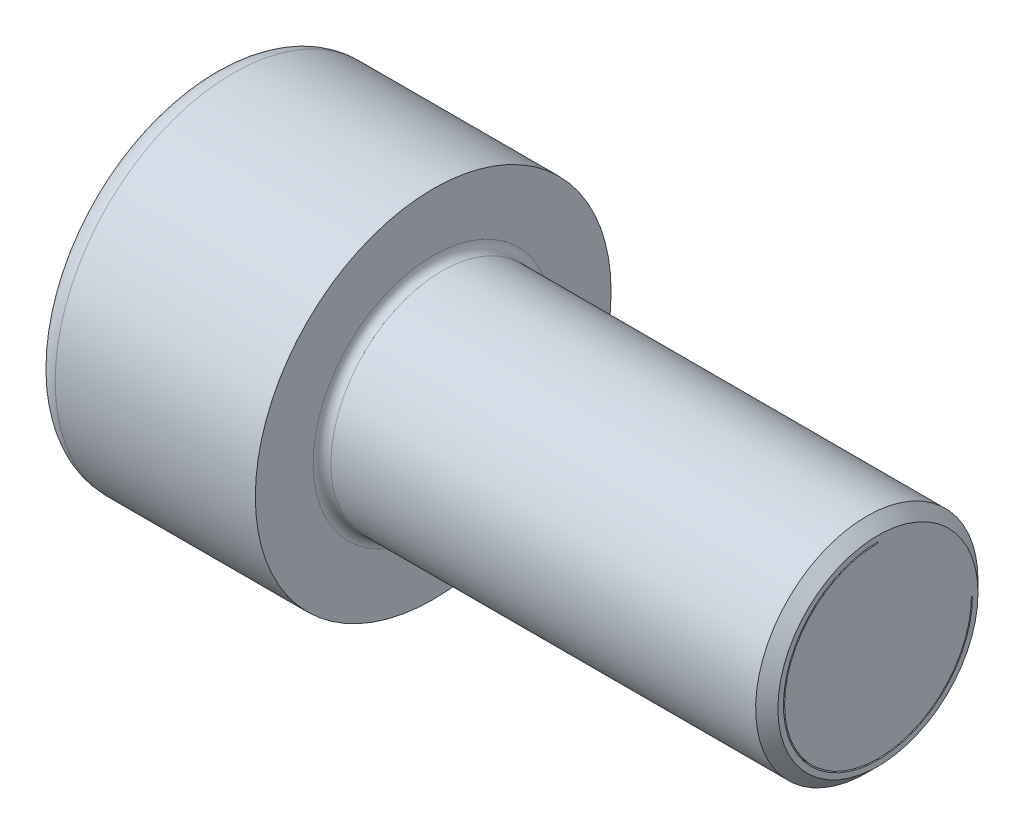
SolidWorks part; units mm, degrees
ref_plane "Plan de face" through (0, 0, 0) normal (0, 0, 1) x (1, 0, 0)
ref_plane "Plan de dessus" through (0, 0, 0) normal (0, 1, 0) x (1, 0, 0)
ref_plane "Plan de droite" through (0, 0, 0) normal (1, 0, 0) x (0, 0, -1)
imported_body "Importée1"
chamfer "Chanfrein1" distance 0.5 angle 45
